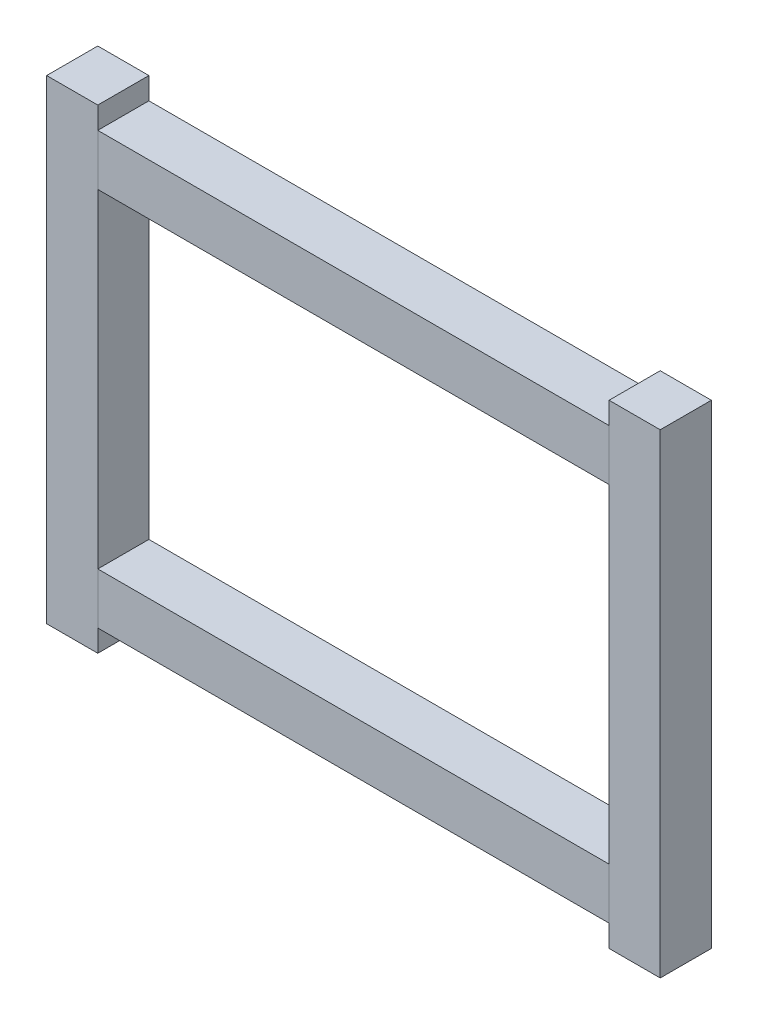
SolidWorks part; units mm, degrees
ref_plane "Plan de face" through (0, 0, 0) normal (0, 0, 1) x (1, 0, 0)
ref_plane "Plan de dessus" through (0, 0, 0) normal (0, 1, 0) x (1, 0, 0)
ref_plane "Plan de droite" through (0, 0, 0) normal (1, 0, 0) x (0, 0, -1)
sketch "Esquisse1" plane through (0, 0, 0) normal (0, 0, 1) x (1, 0, 0)
  line L1 (0, -6) -> (-14, -6)
  line L2 (0, -6) -> (0, 124)
  line L3 (0, 124) -> (-14, 124)
  line L4 (-14, -6) -> (-14, 124)
  dimension "D1" = 14
  dimension "D2" = 6
  dimension "D3" = 130
extrude "Boss.-Extru.1" add sketch "Esquisse1" along normal blind 14
sketch "Esquisse2" plane through (0, 0, 0) normal (0, 0, 1) x (1, 0, 0)
  line L1 (0, 0) -> (140, 0)
  line L2 (0, 0) -> (0, 14)
  line L3 (0, 14) -> (140, 14)
  line L4 (140, 0) -> (140, 14)
  dimension "D1" = 140
  dimension "D2" = 14
extrude "Boss.-Extru.2" add sketch "Esquisse2" along normal blind 14 separate body
sketch "Esquisse3" plane through (0, -6, 0) normal (0, -1, 0) x (1, 0, 0)
  line L0 (140, 14) -> (140, 0) construction
  line L1 (140, 0) -> (154, 0)
  line L2 (140, 0) -> (140, 14)
  line L3 (140, 14) -> (154, 14)
  line L4 (154, 0) -> (154, 14)
  line L5 (-14, 0) -> (0, 0) construction
  line L6 (-14, 14) -> (0, 14) construction
extrude "Boss.-Extru.3" add sketch "Esquisse3" against normal up to surface (130 mm away) separate body
sketch "Esquisse4" plane through (0, 0, 0) normal (1, 0, 0) x (0, 0, -1)
  line L0 (-14, -6) -> (-14, 124) construction
  line L1 (-14, 104) -> (0, 104)
  line L2 (-14, 104) -> (-14, 118)
  line L3 (-14, 118) -> (0, 118)
  line L4 (0, 104) -> (0, 118)
  line L5 (0, -6) -> (0, 124) construction
  line L6 (-14, 124) -> (0, 124) construction
  dimension "D1" = 6
  dimension "D2" = 14
extrude "Boss.-Extru.4" add sketch "Esquisse4" along normal up to next separate body
